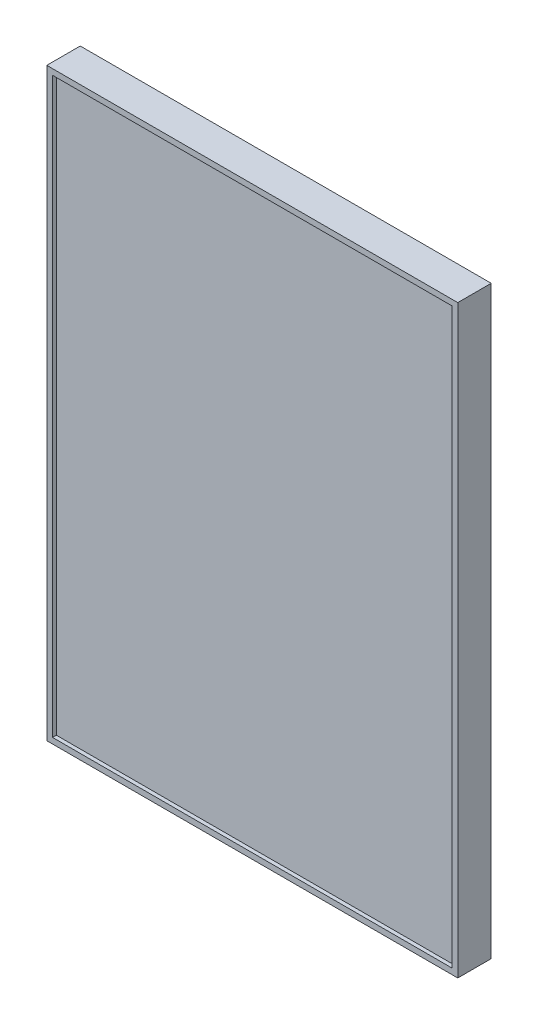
SolidWorks part; units mm, degrees
ref_plane "Plan de face" through (0, 0, 0) normal (0, 0, 1) x (1, 0, 0)
ref_plane "Plan de dessus" through (0, 0, 0) normal (0, 1, 0) x (1, 0, 0)
ref_plane "Plan de droite" through (0, 0, 0) normal (1, 0, 0) x (0, 0, -1)
sketch "Esquisse1" plane through (0, 0, 0) normal (0, 0, 1) x (1, 0, 0)
  line L0 (0, 0) -> (215, 0)
  line L1 (215, 0) -> (215, 306)
  line L2 (215, 306) -> (0, 306)
  line L3 (0, 306) -> (0, 0)
  dimension "D1" = 215
  dimension "D2" = 306
extrude "Boss.-Extru.4" add sketch "Esquisse1" along normal blind 17.5
shell "Coque1" thickness 5
sketch "Esquisse5" plane through (0, 0, 0) normal (0, 0, -1) x (-1, 0, 0)
  line L0 (-215, 0) -> (-215, 306) construction
  line L1 (-210, 301) -> (-5, 301)
  line L2 (-210, 301) -> (-210, 5)
  line L3 (-210, 5) -> (-5, 5)
  line L4 (-5, 301) -> (-5, 5)
  line L5 (-198.5, 288.5) -> (-16.5, 288.5)
  line L6 (-198.5, 288.5) -> (-198.5, 16.5)
  line L7 (-198.5, 16.5) -> (-16.5, 16.5)
  line L8 (-16.5, 288.5) -> (-16.5, 16.5)
  line L10 (0, 0) -> (-215, 0) construction
  dimension "D1" = 16.5
  dimension "D2" = 16.5
  dimension "D3" = 182
  dimension "D4" = 272
extrude "Boss.-Extru.6" add sketch "Esquisse5" against normal blind 1.5
shell "Coque2" thickness 3
